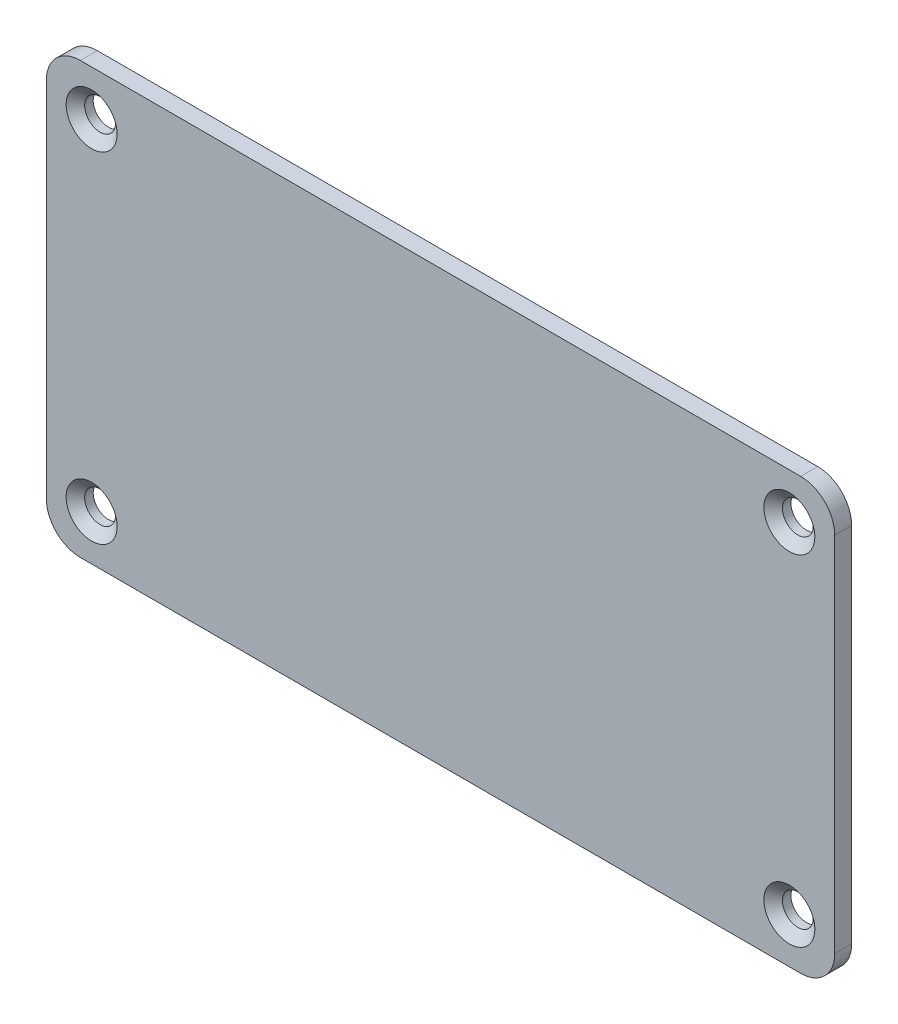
SolidWorks part; units mm, degrees
ref_plane "Front Plane" through (0, 0, 0) normal (0, 0, 1) x (1, 0, 0)
ref_plane "Top Plane" through (0, 0, 0) normal (0, 1, 0) x (1, 0, 0)
ref_plane "Right Plane" through (0, 0, 0) normal (1, 0, 0) x (0, 0, -1)
sketch "Sketch1" plane through (0, 0, 0) normal (0, 0, 1) x (1, 0, 0)
  line L1 (-44.1226, -7.3002) -> (44.2694, -7.3002)
  line L2 (-44.1226, -7.3002) -> (-44.1226, -55.5602)
  line L3 (-44.1226, -55.5602) -> (44.2694, -55.5602)
  line L4 (44.2694, -7.3002) -> (44.2694, -55.5602)
  line L5 (-44.1226, -7.3002) -> (44.2694, -55.5602) construction
  line L6 (-44.1226, -55.5602) -> (44.2694, -7.3002) construction
  circle A0 centre (39.1894, -50.4802) radius 1.4732 construction
  circle A1 centre (-39.0426, -12.3802) radius 1.4732 construction
  point P0 (0.0734, -31.4302)
  dimension "D1" = 5.08
  dimension "D2" = 5.08
  dimension "D3" = 5.08
  dimension "D4" = 5.08
extrude "Boss-Extrude1" add sketch "Sketch1" against normal up to surface (1.905 mm away)
hole_wizard "CSK for #4 Flat Head Machine Screw (100)1" positions "Sketch3" profile "Sketch2" countersink size "#4" standard "ANSI Inch"
sketch "Sketch3" plane through (0, 0, 0) normal (0, 0, 1) x (1, 0, 0)
  point P0 (-39.0426, -12.3802)
  point P3 (39.1894, -12.3802)
  point P6 (-39.0426, -50.4802)
  point P9 (39.1894, -50.4802)
sketch "Sketch2" plane through (-39.0426, -12.3802, 0) normal (1, 0, 0) x (0, -1, 0)
  line L0 (0, 0) -> (0, 1.905)
  line L1 (0, 1.905) -> (1.7272, 1.905)
  line L2 (1.7272, 1.905) -> (1.7272, 0.9484)
  line L3 (1.7272, 0.9484) -> (2.8575, 0)
  line L5 (2.8575, 0) -> (0, 0)
  line L6 (-1.7272, 0.9484) -> (-2.8575, 0) construction
  line L11 (0, -6.35) -> (0, 107.95) construction
  dimension "Thru Hole Dia." = 3.4544
  dimension "Thru Hole Depth" = 1.905
  dimension "Near C'Sink Dia." = 5.715
  dimension "Near C'Sink Angle" = 100
fillet "Fillet1" radius 3.81 4 edges at (-44.1226, -7.3002, -0.9525) (-44.1226, -55.5602, -0.9525) (44.2694, -55.5602, -0.9525) (44.2694, -7.3002, -0.9525)
